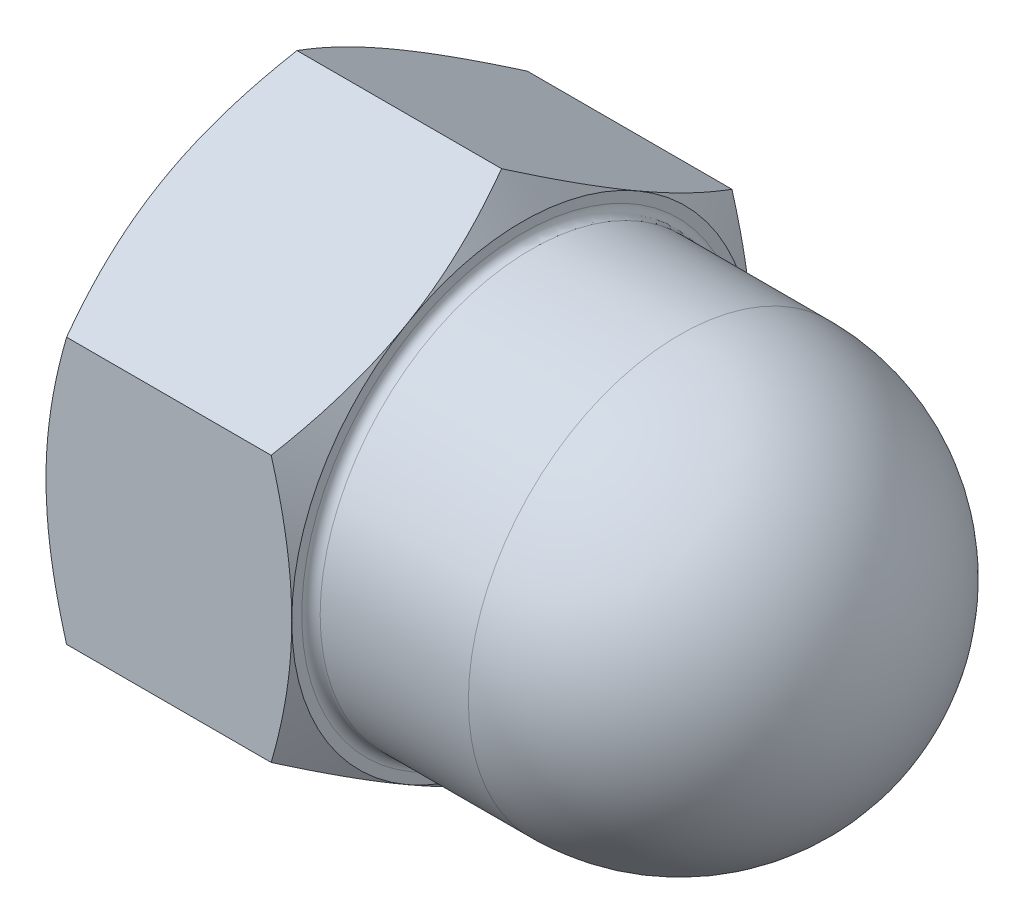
SolidWorks part; units mm, degrees
ref_plane "Plane1" through (0, 0, 0) normal (0, 0, 1) x (1, 0, 0)
ref_plane "Plane2" through (0, 0, 0) normal (0, 1, 0) x (1, 0, 0)
ref_plane "Plane3" through (0, 0, 0) normal (1, 0, 0) x (0, 0, -1)
sketch "BaseNutSke" plane through (0, 0, 0) normal (1, 0, 0) x (0, 0, -1)
  line L6 (3, 1.7321) -> (3, -1.7321)
  line L7 (-3, 1.7321) -> (-3, -1.7321)
  line L8 (3, 1.7321) -> (0, 3.4641)
  line L9 (0, 3.4641) -> (-3, 1.7321)
  line L10 (-3, -1.7321) -> (0, -3.4641)
  line L11 (0, -3.4641) -> (3, -1.7321)
  dimension "D4" = 60
  dimension "D1" = 120
  dimension "D2" = 3
  dimension "D3" = 3
  dimension "Width_flats" = 6
extrude "BaseNut" add sketch "BaseNutSke" along normal blind 3.2
sketch "DomeSke" plane through (0, 0, 0) normal (0, 0, 1) x (1, 0, 0)
  line L0 (0, 0) -> (63.5, 0) construction
  line L1 (0, 1.7321) -> (0, -1.7321) construction
  line L2 (8, 0) -> (0, 0)
  line L3 (0, 2.75) -> (5.25, 2.75)
  line L4 (0, -2.75) -> (22.225, -13.5) construction
  line L5 (0, 2.75) -> (0, 0)
  arc A0 (5.25, 2.75) -> (8, 0) centre (5.25, 0) cw
  dimension "Dome_rad" = 2.75
  dimension "Overall_ht" = 8
revolve "Dome" add sketch "DomeSke" angle 360 about L0
sketch "Sketch4" plane through (0, 0, 0) normal (0, 0, 1) x (1, 0, 0)
  line L0 (0, 3) -> (0.5566, 3.9641)
  line L1 (3.2, 3) -> (2.6434, 3.9641)
  line L2 (0.5566, 3.9641) -> (2.6434, 3.9641)
  line L3 (3.2, 3) -> (5.2, 3)
  line L4 (5.2, 3) -> (5.2, 18)
  line L5 (5.2, 18) -> (-2, 18)
  line L6 (0, 3) -> (-2, 3)
  line L7 (-2, 3) -> (-2, 18)
  line L8 (3.2, 3.4641) -> (3.2, 1.7321) construction
  line L9 (0, 3.4641) -> (0, 1.7321) construction
  line L10 (0, 0) -> (57.15, 0) construction
  line L11 (3.2, 3.4641) -> (0, 3.4641) construction
  point P17 (3.2, 3)
  dimension "D1" = 30
  dimension "D2" = 30
  dimension "D3" = 2
  dimension "D4" = 2
  dimension "D5" = 0.5
  dimension "D6" = 15
  dimension "D7" = 3
revolve "DoubleChamfer" cut sketch "Sketch4" angle 360 about L10
sketch "TapDriSke" plane through (0, 0, 0) normal (0, 0, 1) x (1, 0, 0)
  line L0 (0, 0) -> (44.45, 0) construction
  line L1 (0, 1.65) -> (4.8, 1.65)
  line L2 (0, 0) -> (0, -2.5981) construction
  line L3 (4.8, 1.65) -> (5.7914, 0)
  line L4 (0, 0) -> (63.5, 0) construction
  line L5 (5.7914, 0) -> (0, 0)
  line L6 (0, 0) -> (0, 1.65)
  line L7 (4.8, -1.65) -> (5.7914, 0) construction
  line L8 (0, -1.65) -> (4.8, -1.65) construction
  line L9 (1, 6.35) -> (1, 3.175) construction
  dimension "TPA" = 118
  dimension "Thread_min" = 3.3
  dimension "Drill_depth" = 4.8
  dimension "Drill_clr" = 2
revolve "TapDrill" cut sketch "TapDriSke"
revolve "EndChamfer" cut sketch "EndChamferSketch" angle 360 about L4
sketch "EndChamferSketch" plane through (0, 0, 0) normal (0, 0, 1) x (1, 0, 0)
  line L0 (-0.0254, 2) -> (0.0254, 2)
  line L1 (0.0254, 2) -> (0.295, 1.615)
  line L2 (0.295, 1.615) -> (-0.0254, 1.615)
  line L3 (-0.0254, 1.615) -> (-0.0254, 2)
  line L4 (0, 0) -> (-15.875, 0) construction
  dimension "D1" = 0.0508
  dimension "D2" = 35
  dimension "D3" = 0.0254
  dimension "ChamferDepth" = 0.385
  dimension "ThreadMajor" = 2
revolve "Undercut" cut sketch "UcutSke" angle 360 about L0
sketch "UcutSke" plane through (0, 0, 0) normal (0, 0, 1) x (1, 0, 0)
  line L0 (0, 0) -> (38.1, 0) construction
  line L1 (4.0736, 2.02) -> (3.86, 1.65)
  line L2 (3.86, 0.25) -> (5.26, 0.25)
  line L3 (5.26, 0.25) -> (5.26, 2.02)
  line L4 (5.26, 2.02) -> (4.0736, 2.02)
  line L5 (3.86, 0.25) -> (3.86, 1.65)
  line L6 (4.8, 1.65) -> (0, 1.65) construction
  line L7 (0, 0) -> (0, -2.5981) construction
  dimension "D1" = 0.5
  dimension "D2" = 240
  dimension "Ucut_dia" = 4.04
  dimension "Ucut_dep" = 5.26
  dimension "Ucut_wid" = 1.4
sketch "ThdSchSke" plane through (0, 0, 0) normal (0, 1, 0) x (1, 0, 0)
  line L0 (0.0381, 2) -> (-0.207, 1.65)
  line L1 (-0.207, 1.65) -> (-0.207, 0.825)
  line L2 (-0.207, 0.825) -> (0.2832, 0.825)
  line L3 (0.2832, 0.825) -> (0.2832, 1.65)
  line L4 (0.2832, 1.65) -> (0.0381, 2)
  line L5 (-38.1, 0) -> (3.175, 0) construction
  line L6 (0, 0) -> (-15.875, 0) construction
  line L7 (0, 0) -> (63.5, 0) construction
  line L9 (0.7381, -7.525) -> (0.7381, -13.875) construction
  dimension "D1" = 0.0381
  dimension "VeeAngle" = 70
  dimension "SideAngle" = 55
  dimension "Thread_major" = 4
  dimension "Tap_drill" = 3.3
  dimension "OverCut" = 1.65
  dimension "Advance" = 0.7
revolve "ThreadSchematic" [suppressed] cut sketch "ThdSchSke" angle 360 about L5
pattern_linear "ThdSchPat" [suppressed]
fillet "DomeFillet" radius 0.12 1 edges at (3.2, 0, -2.75)
equation "' \"Width_flats@BaseNutSke\" = 30"
equation "' \"Hex_ht@BaseNut\" = 16"
equation "' \"Overall_ht@DomeSke\" = 34"
equation "' \"Dome_rad@DomeSke\" = 14"
equation "' \"Thread_min@TapDriSke\" = 17.5"
equation "' \"Drill_clr@TapDriSke\" = 5.0"
equation "' \"Advance@ThdSchSke\" = 2.5"
equation "' \"Thread_nominal@ThreadCosmetic\" = 20"
equation "' \"Radius@DomeFillet\" = 0.5"
equation "' \"Ucut_wid@UcutSke\" = 9.3"
equation "' \"Ucut_dep@UcutSke\" = 26.42"
equation "\"Drill_depth@TapDriSke\" = \"Overall_ht@DomeSke\"  - \"Drill_clr@TapDriSke\" - 0.3 * \"Thread_nominal@ThreadCosmetic\""
equation "\"Ucut_dia@UcutSke\" = \"Thread_nominal@ThreadCosmetic\" * 1.01"
equation "\"Thread_depth@ThreadCosmetic\" = \"Ucut_dep@UcutSke\" - \"Ucut_wid@UcutSke\" + ( \"Thread_nominal@ThreadCosmetic\" - \"Thread_min@TapDriSke\" ) / 2 * 0.57735"
equation "\"D2@BaseNutSke\" = \"Width_flats@BaseNutSke\" / 2"
equation "\"D3@BaseNutSke\" = \"Width_flats@BaseNutSke\" / 2"
equation "\"D7@Sketch4\" = \"Width_flats@BaseNutSke\" / 2"
equation "\"D5@Sketch4\" = \"Width_flats@BaseNutSke\" / 12"
equation "\"Thread_major@ThdSchSke\" = \"Thread_nominal@ThreadCosmetic\""
equation "\"Tap_drill@ThdSchSke\" = \"Thread_min@TapDriSke\""
equation "\"Overcut@ThdSchSke\" = \"Tap_drill@ThdSchSke\" * 0.5"
equation "\"Num_threads@ThdSchPat\" = int(  ( \"Thread_depth@ThreadCosmetic\" - 0.002 ) / \"Advance@ThdSchSke\" + 0.999 )  + 1"
equation "\"Advance@ThdSchPat\" = ( \"Thread_depth@ThreadCosmetic\" - 0.002 ) /  (\"Num_threads@ThdSchPat\" - 1) 'relax it"
equation "\"ThreadMajor@EndChamferSketch\" = \"Thread_nominal@ThreadCosmetic\" * 0.5"
equation "\"ChamferDepth@EndChamferSketch\" = (\"Thread_nominal@ThreadCosmetic\" - \"Thread_min@TapDriSke\") * 0.55"
